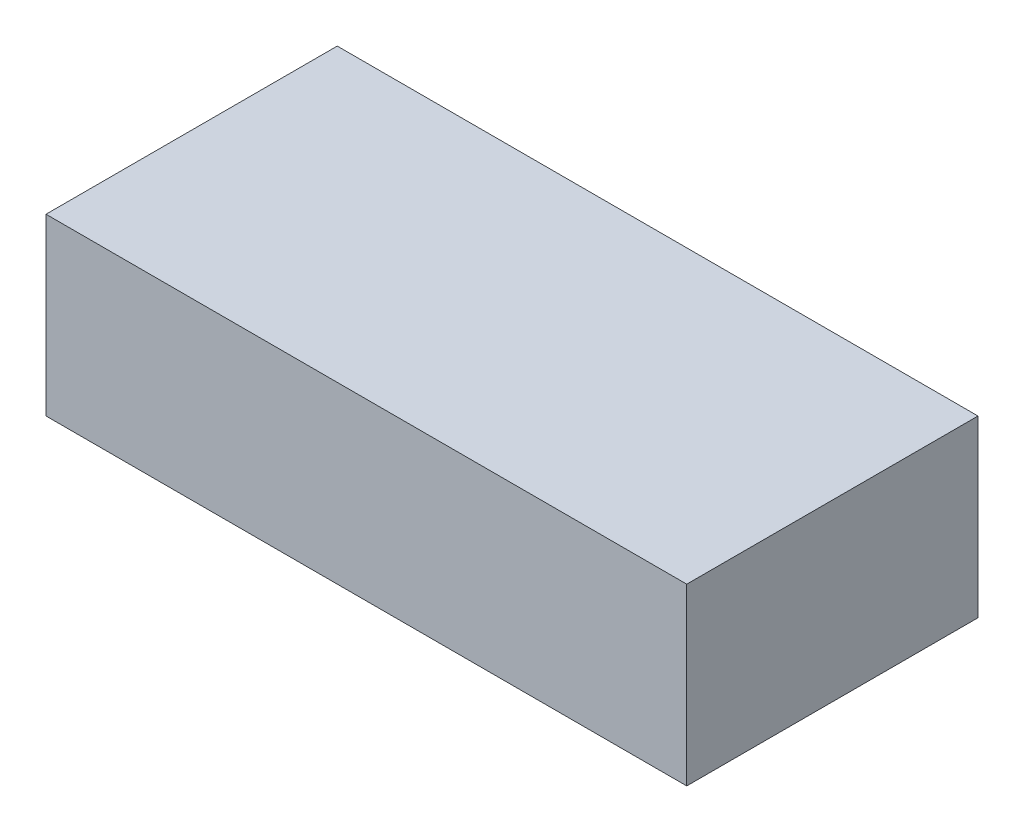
SolidWorks part; units mm, degrees
ref_plane "Front Plane" through (0, 0, 0) normal (0, 0, 1) x (1, 0, 0)
ref_plane "Top Plane" through (0, 0, 0) normal (0, 1, 0) x (1, 0, 0)
ref_plane "Right Plane" through (0, 0, 0) normal (1, 0, 0) x (0, 0, -1)
sketch "Sketch2" plane through (0, 0, 0) normal (0, 1, 0) x (1, 0, 0)
  line L1 (0, 0) -> (-139.7, 0)
  line L2 (0, 0) -> (0, 63.5)
  line L3 (0, 63.5) -> (-139.7, 63.5)
  line L4 (-139.7, 0) -> (-139.7, 63.5)
  dimension "D1" = 139.7
  dimension "D2" = 63.5
extrude "Extrude1" add sketch "Sketch2" along normal blind 38.1
